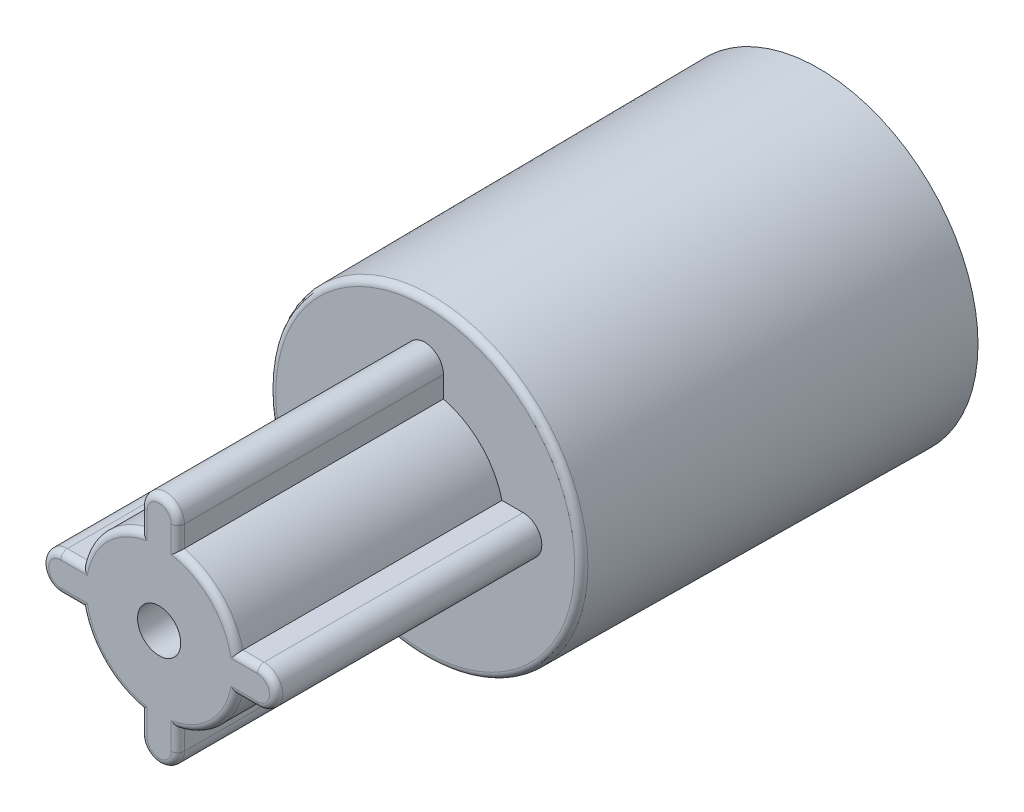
SolidWorks part; units mm, degrees
ref_plane "Plane1" through (0, 0, 0) normal (0, 0, 1) x (1, 0, 0)
ref_plane "Plane2" through (0, 0, 0) normal (0, 1, 0) x (1, 0, 0)
ref_plane "Plane3" through (0, 0, 0) normal (1, 0, 0) x (0, 0, -1)
sketch "Sketch1" plane through (0, 0, 0) normal (0, 0, 1) x (1, 0, 0)
  circle A0 centre (0, 0) radius 9.6
  dimension "D1" = 19.2
extrude "Base-Extrude" add sketch "Sketch1" along normal blind 23.7
sketch "Sketch2" plane through (0, 0, 0) normal (0, 0, -1) x (-1, 0, 0)
  line L0 (1.1513, 6.0166) -> (1.1513, 4.7416)
  line L1 (5.9522, 1.2157) -> (4.6772, 1.2157)
  line L2 (-5.8995, 1.2157) -> (-4.6245, 1.2157)
  line L3 (-1.0987, 6.0166) -> (-1.0987, 4.7416)
  line L4 (-5.8995, -1.0343) -> (-4.6245, -1.0343)
  line L5 (1.1513, -5.8351) -> (1.1513, -4.5601)
  line L6 (5.9522, -1.0343) -> (4.6772, -1.0343)
  line L7 (-1.0987, -4.5601) -> (-1.0987, -5.8351)
  arc A0 (4.6772, 1.2157) -> (1.1513, 4.7416) centre (0.0263, 0.0907) ccw
  arc A1 (5.9522, -1.0343) -> (7.0772, 0.0907) centre (5.9522, 0.0907) ccw
  arc A2 (7.0772, 0.0907) -> (5.9522, 1.2157) centre (5.9522, 0.0907) ccw
  arc A3 (-5.8995, 1.2157) -> (-7.0245, 0.0907) centre (-5.8995, 0.0907) ccw
  arc A4 (-1.0987, 4.7416) -> (-4.6245, 1.2157) centre (0.0263, 0.0907) ccw
  arc A5 (0.0263, 7.1416) -> (-1.0987, 6.0166) centre (0.0263, 6.0166) ccw
  arc A6 (1.1513, 6.0166) -> (0.0263, 7.1416) centre (0.0263, 6.0166) ccw
  arc A7 (-7.0245, 0.0907) -> (-5.8995, -1.0343) centre (-5.8995, 0.0907) ccw
  arc A8 (-4.6245, -1.0343) -> (-1.0987, -4.5601) centre (0.0263, 0.0907) ccw
  arc A9 (-1.0987, -5.8351) -> (1.1513, -5.8351) centre (0.0263, -5.8351) ccw
  arc A10 (1.1513, -4.5601) -> (4.6772, -1.0343) centre (0.0263, 0.0907) ccw
extrude "Cut-Extrude1" cut sketch "Sketch2" against normal blind 21.7
sketch "Sketch3" plane through (0, 0, 23.7) normal (0, 0, 1) x (1, 0, 0)
  line L8 (-1.1513, 6.0166) -> (-1.1513, 4.7416)
  line L9 (-5.9522, 1.2157) -> (-4.6772, 1.2157)
  line L10 (-5.9522, -1.0343) -> (-4.6772, -1.0343)
  line L11 (-1.1513, -5.8351) -> (-1.1513, -4.5601)
  line L12 (1.0987, -4.5601) -> (1.0987, -5.8351)
  line L13 (5.8995, -1.0343) -> (4.6245, -1.0343)
  line L14 (5.8995, 1.2157) -> (4.6245, 1.2157)
  line L15 (1.0987, 6.0166) -> (1.0987, 4.7416)
  line L16 (-1.1513, 6.0166) -> (-1.1513, 4.7416)
  line L17 (-5.9522, 1.2157) -> (-4.6772, 1.2157)
  line L18 (-5.9522, -1.0343) -> (-4.6772, -1.0343)
  line L19 (-1.1513, -5.8351) -> (-1.1513, -4.5601)
  line L20 (1.0987, -4.5601) -> (1.0987, -5.8351)
  line L21 (5.8995, -1.0343) -> (4.6245, -1.0343)
  line L22 (5.8995, 1.2157) -> (4.6245, 1.2157)
  line L23 (1.0987, 6.0166) -> (1.0987, 4.7416)
  arc A11 (-1.1513, 4.7416) -> (-4.6772, 1.2157) centre (-0.0263, 0.0907) ccw
  arc A12 (-5.9522, 1.2157) -> (-7.0772, 0.0907) centre (-5.9522, 0.0907) ccw
  arc A13 (-7.0772, 0.0907) -> (-5.9522, -1.0343) centre (-5.9522, 0.0907) ccw
  arc A14 (-4.6772, -1.0343) -> (-1.1513, -4.5601) centre (-0.0263, 0.0907) ccw
  arc A15 (-1.1513, -5.8351) -> (1.0987, -5.8351) centre (-0.0263, -5.8351) ccw
  arc A16 (1.0987, -4.5601) -> (4.6245, -1.0343) centre (-0.0263, 0.0907) ccw
  arc A17 (5.8995, -1.0343) -> (7.0245, 0.0907) centre (5.8995, 0.0907) ccw
  arc A18 (7.0245, 0.0907) -> (5.8995, 1.2157) centre (5.8995, 0.0907) ccw
  arc A19 (4.6245, 1.2157) -> (1.0987, 4.7416) centre (-0.0263, 0.0907) ccw
  arc A20 (1.0987, 6.0166) -> (-0.0263, 7.1416) centre (-0.0263, 6.0166) ccw
  arc A21 (-0.0263, 7.1416) -> (-1.1513, 6.0166) centre (-0.0263, 6.0166) ccw
  arc A22 (-1.1513, 4.7416) -> (-4.6772, 1.2157) centre (-0.0263, 0.0907) ccw
  arc A23 (-5.9522, 1.2157) -> (-7.0772, 0.0907) centre (-5.9522, 0.0907) ccw
  arc A24 (-7.0772, 0.0907) -> (-5.9522, -1.0343) centre (-5.9522, 0.0907) ccw
  arc A25 (-4.6772, -1.0343) -> (-1.1513, -4.5601) centre (-0.0263, 0.0907) ccw
  arc A26 (-1.1513, -5.8351) -> (1.0987, -5.8351) centre (-0.0263, -5.8351) ccw
  arc A27 (1.0987, -4.5601) -> (4.6245, -1.0343) centre (-0.0263, 0.0907) ccw
  arc A28 (5.8995, -1.0343) -> (7.0245, 0.0907) centre (5.8995, 0.0907) ccw
  arc A29 (7.0245, 0.0907) -> (5.8995, 1.2157) centre (5.8995, 0.0907) ccw
  arc A30 (4.6245, 1.2157) -> (1.0987, 4.7416) centre (-0.0263, 0.0907) ccw
  arc A31 (1.0987, 6.0166) -> (-0.0263, 7.1416) centre (-0.0263, 6.0166) ccw
  arc A32 (-0.0263, 7.1416) -> (-1.1513, 6.0166) centre (-0.0263, 6.0166) ccw
  dimension "D1" = 0
extrude "Boss-Extrude1" add sketch "Sketch3" along normal blind 16
sketch "Sketch4" plane through (0, 0, 39.7) normal (0, 0, 1) x (1, 0, 0)
  circle A0 centre (-0.0263, 0.0907) radius 1.3
  dimension "D1" = 2.6
extrude "Cut-Extrude2" cut sketch "Sketch4" against normal through all
sketch "Sketch5" plane through (0, 0, 0) normal (1, 0, 0) x (0, 0, -1)
  line L0 (0, 0) -> (-41.9103, 0) construction
  line L1 (-23.7, 0) -> (0, 0) construction
  line L3 (0, 9.6) -> (-23.7, 9.4)
  line L4 (0, -9.6) -> (0, 9.6) construction
  line L6 (-23.7, 9.6) -> (-23.7, -9.6) construction
  line L7 (-23.7, 9.4) -> (-23.7, 9.6)
  line L10 (-23.7, 9.6) -> (0, 9.6)
  dimension "D1" = 0.2
revolve "Cut-Revolve1" cut sketch "Sketch5" angle 360 about L0
fillet "Fillet4" radius 0.4
